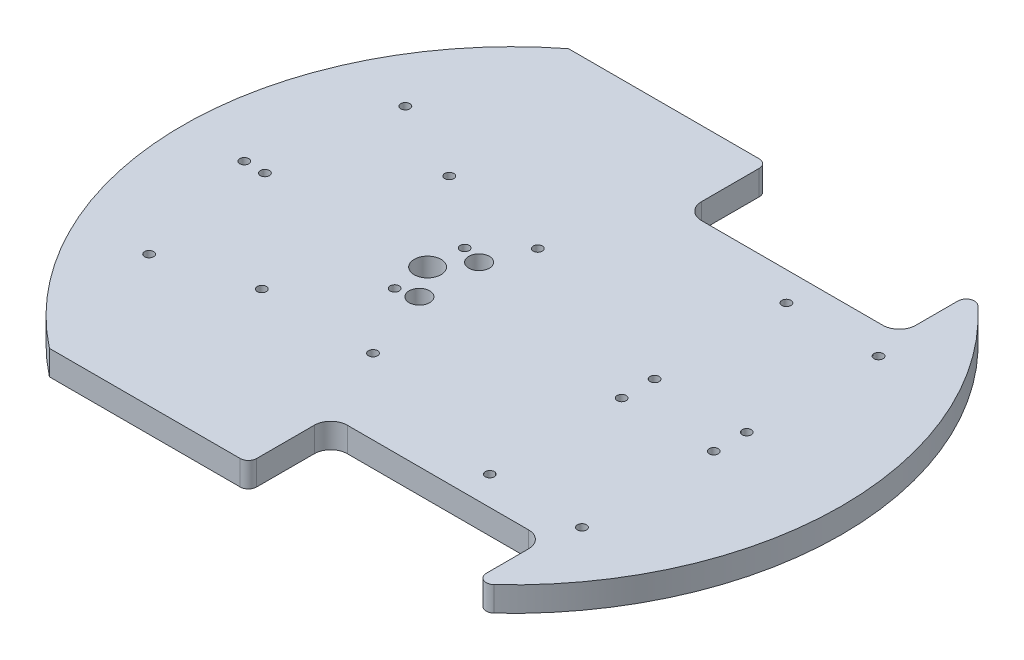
SolidWorks part; units mm, degrees
ref_plane "Plan de face" through (0, 0, 0) normal (0, 0, 1) x (1, 0, 0)
ref_plane "Plan de dessus" through (0, 0, 0) normal (0, 1, 0) x (1, 0, 0)
ref_plane "Plan de droite" through (0, 0, 0) normal (1, 0, 0) x (0, 0, -1)
sketch "Esquisse1" plane through (0, 0, 0) normal (0, 1, 0) x (1, 0, 0)
  line L0 (-111.0793, 0) -> (144.6389, 0) construction
  line L1 (0, -11.2854) -> (0, 92.4278) construction
  line L2 (-127.8768, -35.5) -> (-4.8538, -35.5) construction
  line L3 (-127.8768, 35.5) -> (-3.1135, 35.5) construction
  line L4 (-26, 79.8205) -> (-26, -33.2462) construction
  line L5 (-82, 79.8205) -> (-82, -51.6438) construction
  line L6 (4, 20.8682) -> (4, -38.6395) construction
  line L7 (-47.0686, -40) -> (71.6382, -40) construction
  line L8 (49.5, 20.8682) -> (49.5, -38.6395) construction
  line L9 (15.6, 11.6292) -> (15.6, -28.2202) construction
  line L10 (10.5621, -4) -> (39.9669, -4) construction
  line L11 (37.9, 11.6292) -> (37.9, -28.2202) construction
  line L12 (56.6736, -20) -> (46.2603, -20) construction
  line L13 (44.1725, -43) -> (-30.869, -43) construction
  line L14 (36, -93.4535) -> (36, -41.3056) construction
  line L15 (-16, -93.4535) -> (-16, -38.6395) construction
  line L16 (-111.0793, -63) -> (69.2583, -63) construction
  line L17 (-64.3052, -63) -> (-18, -63)
  line L19 (-16, -61) -> (-16, -47)
  line L20 (36, -57.2276) -> (36, -47)
  line L21 (-12, -43) -> (32, -43)
  line L23 (36, 57.2276) -> (36, 47)
  line L24 (-12, 43) -> (32, 43)
  line L25 (-16, 61) -> (-16, 47)
  line L26 (-64.3052, 63) -> (-18, 63)
  line L27 (-72.5, -38.6395) -> (-72.5, -16.737) construction
  line L28 (-40.7734, -7.25) -> (-7.8843, -7.25) construction
  line L29 (-76.4528, -31.1) -> (-20.4061, -31.1) construction
  line L30 (-35.5, 14.0513) -> (-35.5, -22.158) construction
  line L31 (-30.25, 14.0513) -> (-30.25, -14.8384) construction
  line L32 (-12.5599, 27.75) -> (-60.9041, 27.75) construction
  line L33 (-54, 72.3967) -> (-54, -33.2462) construction
  line L34 (-80, -11.2854) -> (-80, 32.0047) construction
  line L35 (-95, 32.0044) -> (-95, -4) construction
  line L36 (-21, 41.329) -> (-21, -33.2462) construction
  line L37 (-12.5599, -27.75) -> (-60.9041, -27.75) construction
  line L38 (-37.5, 33.5512) -> (-37.5, 25.1634) construction
  line L39 (-56.6585, -24.75) -> (-47.0686, -24.75) construction
  line L40 (-51, -29.0585) -> (-51, -20.8676) construction
  line L41 (-19.4076, 17.25) -> (-28.6669, 17.25) construction
  line L42 (-26, 25.6996) -> (-26, 13.2494) construction
  line L43 (-56.6585, 21.75) -> (-41.986, 21.75) construction
  line L44 (-52, 28.4347) -> (-52, 19.0899) construction
  line L45 (-104, -14.8384) -> (-104, 14.0513) construction
  line L46 (-75, 32.0047) -> (-75, -11.2854) construction
  line L47 (10, 4) -> (10, -84.8277) construction
  line L48 (43.5, 11.6292) -> (43.5, -20) construction
  arc A0 (39.359, -58.695) -> (39.359, 58.695) centre (-15, 0) ccw
  circle A1 centre (15.6, -4) radius 1.1
  circle A2 centre (37.959, -4) radius 1.1
  circle A3 centre (37.959, -36) radius 1.1
  circle A4 centre (15.6, -36) radius 1.1
  circle A5 centre (37.959, 4) radius 1.1
  circle A6 centre (37.959, 36) radius 1.1
  circle A7 centre (15.6, 36) radius 1.1
  circle A8 centre (15.6, 4) radius 1.1
  arc A9 (36, 47) -> (32, 43) centre (32, 47) cw
  arc A10 (-64.3052, 63) -> (-64.3052, -63) centre (-15, 0) ccw
  arc A11 (-12, 43) -> (-16, 47) centre (-12, 47) cw
  arc A12 (32, -43) -> (36, -47) centre (32, -47) cw
  arc A13 (-16, -47) -> (-12, -43) centre (-12, -47) cw
  circle A14 centre (-35, -8.5) radius 1.1
  circle A15 centre (-30.25, 7.25) radius 2.5
  circle A16 centre (-72, -31.1) radius 1.1
  circle A17 centre (-72, 31.1) radius 1.1
  circle A18 centre (-80, 0) radius 1.1
  circle A19 centre (-35, 8.5) radius 1.1
  circle A20 centre (-35.5, 0) radius 3.25
  circle A21 centre (-30.25, -7.25) radius 2.5
  circle A22 centre (-80, 0) radius 9 construction
  circle A23 centre (-51, -24.75) radius 1.1
  circle A24 centre (-24, -24.75) radius 1.1
  circle A25 centre (-26, 17.25) radius 1.1
  circle A26 centre (-52, 21.75) radius 1.1
  circle A27 centre (-15, 0) radius 79 construction
  circle A28 centre (-75, 0) radius 1.1
  arc A29 (36, -57.2276) -> (39.359, -58.695) centre (38, -57.2276) ccw
  arc A30 (-18, -63) -> (-16, -61) centre (-18, -61) ccw
  arc A31 (39.359, 58.695) -> (36, 57.2276) centre (38, 57.2276) ccw
  arc A32 (-16, 61) -> (-18, 63) centre (-18, 61) ccw
  point P58 (36, 43)
  point P66 (-16, 43)
  point P69 (36, -61.636)
  point P71 (36, -43)
  point P74 (-16, -43)
  point P150 (-16, -63)
  point P155 (-16, 63)
  dimension "D8" = 20
  dimension "D9" = 4
  dimension "D13" = 52
  dimension "D12" = 26
  dimension "D16" = 4
  dimension "D21" = 5.25
  dimension "D22" = 28
  dimension "D23" = 15
  dimension "D24" = 33
  dimension "D30" = 10.5
  dimension "D34" = 20
  dimension "D35" = 6
  dimension "D36" = 2
  dimension "D1" = 30
  dimension "D2" = 56
  dimension "D3" = 35.5
  dimension "D4" = 71
  dimension "D5" = 40
  dimension "D6" = 6
  dimension "D7" = 45.5
  dimension "D10" = 11.6
  dimension "D11" = 22.3
  dimension "D14" = 3
  dimension "D15" = 20
  dimension "D17" = 7.25
  dimension "D18" = 37
  dimension "D19" = 31.1
  dimension "D20" = 9.5
  dimension "D25" = 27.75
  dimension "D26" = 55.5
  dimension "D27" = 16.5
  dimension "D28" = 3
  dimension "D29" = 3
  dimension "D31" = 5
  dimension "D32" = 2
  dimension "D33" = 6
extrude "Extrusion1" add sketch "Esquisse1" along normal blind 6
